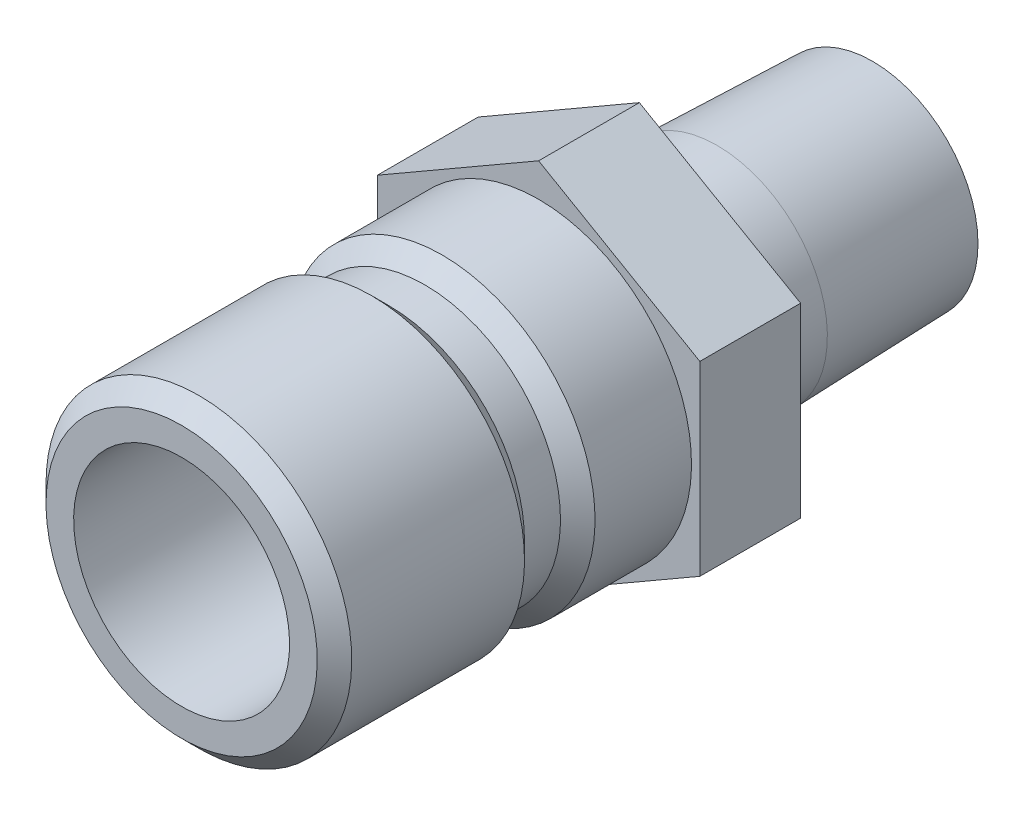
SolidWorks part; units mm, degrees
ref_plane "Front Plane" through (0, 0, 0) normal (0, 0, 1) x (1, 0, 0)
ref_plane "Top Plane" through (0, 0, 0) normal (0, 1, 0) x (1, 0, 0)
ref_plane "Right Plane" through (0, 0, 0) normal (1, 0, 0) x (0, 0, -1)
sketch "Sketch1" plane through (0, 0, 0) normal (1, 0, 0) x (0, 0, -1)
  line L0 (0, 0) -> (-18.923, 0) construction
  line L1 (-15.748, 4.7625) -> (-15.748, 5.9817)
  line L2 (-6.604, 5.9817) -> (-6.604, 0) construction
  line L3 (-14.986, 6.7437) -> (-7.366, 6.7437)
  line L4 (0, 4.8641) -> (0, 0) construction
  line L5 (-6.604, 5.9817) -> (-5.0165, 5.9817)
  line L6 (-4.2545, 6.7437) -> (0, 6.7437)
  line L7 (0, 6.7437) -> (0, 4.8641)
  line L8 (-6.604, 5.9817) -> (-7.366, 6.7437)
  line L9 (-5.0165, 5.9817) -> (-4.2545, 6.7437)
  line L10 (-15.748, 5.9817) -> (-14.986, 6.7437)
  line L11 (-15.748, 4.7625) -> (-3.556, 4.7625)
  line L12 (0, 4.8641) -> (7.874, 4.8641)
  line L13 (7.874, 4.8641) -> (14.732, 4.6498)
  line L14 (14.732, 4.6498) -> (14.732, 3.4163)
  line L15 (0, 0) -> (4.445, 0) construction
  line L17 (-2.8402, 3.4163) -> (14.732, 3.4163)
  line L18 (-3.556, 4.7625) -> (-2.8402, 3.4163)
  dimension "D1" = 15.748
  dimension "D2" = 1.5875
  dimension "D3" = 0.762
  dimension "D4" = 45
  dimension "D5" = 9.144
  dimension "D6" = 45
  dimension "D7" = 1.79
  dimension "D8" = 6.858
  dimension "D9" = 30.48
  dimension "D10" = 3.175
  dimension "D11" = 9.525
  dimension "D12" = 9.7282
  dimension "D13" = 4.445
  dimension "D14" = 13.4874
  dimension "D15" = 6.8326
  dimension "D16" = 12.192
  dimension "D17" = 118
revolve "Revolve1" add sketch "Sketch1" angle 360 about L0
sketch "Sketch2" plane through (0, 0, 0) normal (0, 0, 1) x (1, 0, 0)
  line L1 (-7.112, 4.1061) -> (-7.112, -4.1061)
  line L2 (-7.112, -4.1061) -> (0, -8.2122)
  line L3 (0, -8.2122) -> (7.112, -4.1061)
  line L4 (7.112, -4.1061) -> (7.112, 4.1061)
  line L5 (7.112, 4.1061) -> (0, 8.2122)
  line L6 (0, 8.2122) -> (-7.112, 4.1061)
  circle A0 centre (0, 0) radius 7.112 construction
  circle A1 centre (0, 0) radius 3.4163 construction
  circle A2 centre (0, 0) radius 3.4163
  dimension "D1" = 14.224
extrude "Boss-Extrude1" add sketch "Sketch2" against normal up to vertex (4.445 mm away)
